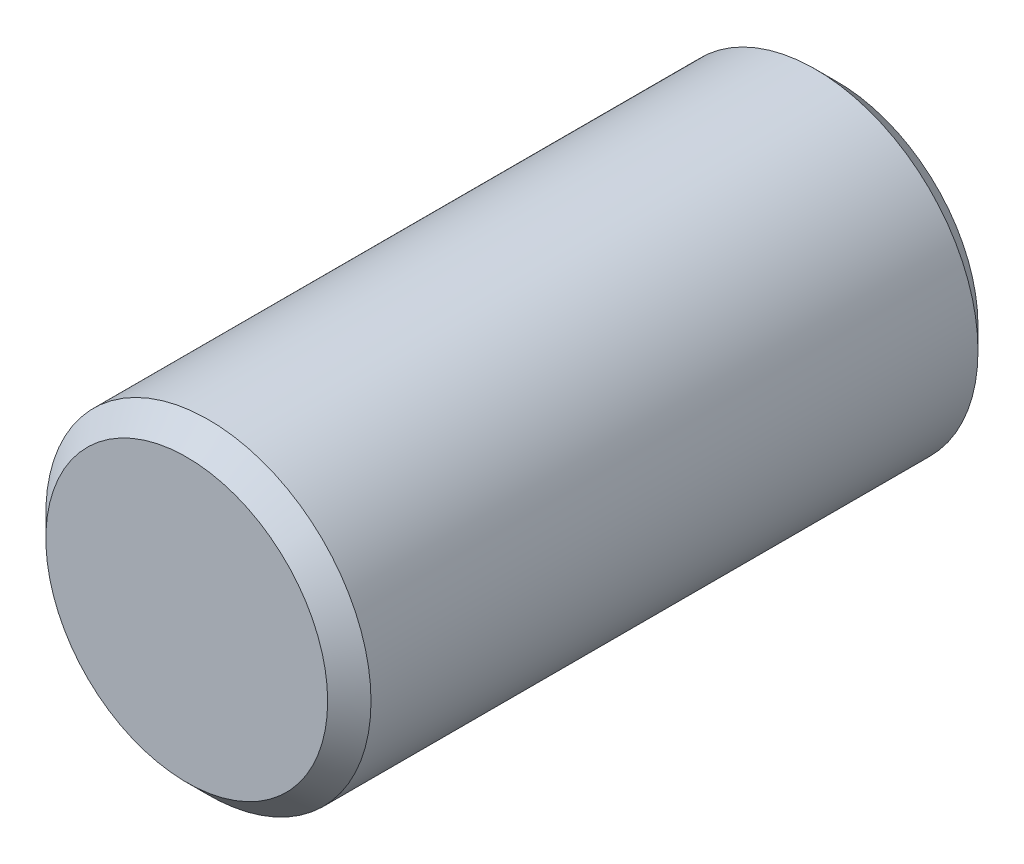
SolidWorks part; units mm, degrees
ref_plane "Plan de face" through (0, 0, 0) normal (0, 0, 1) x (1, 0, 0)
ref_plane "Plan de dessus" through (0, 0, 0) normal (0, 1, 0) x (1, 0, 0)
ref_plane "Plan de droite" through (0, 0, 0) normal (1, 0, 0) x (0, 0, -1)
sketch "Esquisse1" plane through (0, 0, 0) normal (0, 0, 1) x (1, 0, 0)
  circle A0 centre (0, 0) radius 1.5
  dimension "D1" = 3
extrude "Extrusion1" add sketch "Esquisse1" along normal blind 6
chamfer "Chanfrein1" distance 0.2 angle 45 2 edges at (1.5, 0, 0) (1.5, 0, 6)
